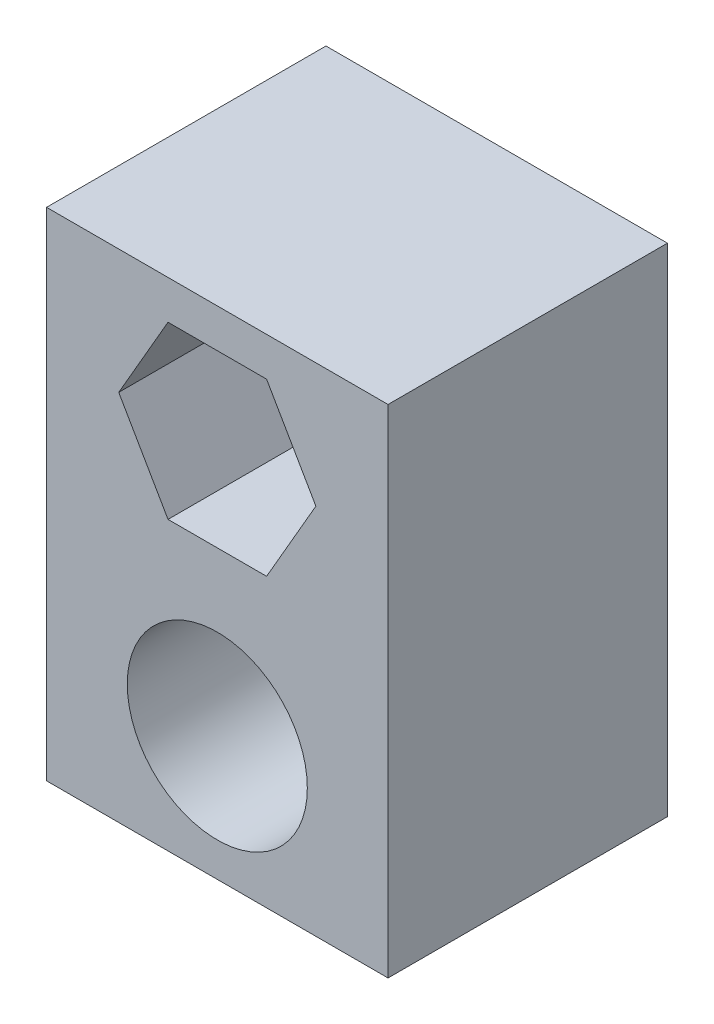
SolidWorks part; units mm, degrees
ref_plane "前视基准面" through (0, 0, 0) normal (0, 0, 1) x (1, 0, 0)
ref_plane "上视基准面" through (0, 0, 0) normal (0, 1, 0) x (1, 0, 0)
ref_plane "右视基准面" through (0, 0, 0) normal (1, 0, 0) x (0, 0, -1)
other "Configuration Table"
sketch "草图1" plane through (0, 0, 0) normal (0, 0, 1) x (1, 0, 0)
  line L1 (0, 0) -> (11, 0)
  line L2 (0, 0) -> (0, -16)
  line L3 (0, -16) -> (11, -16)
  line L4 (11, 0) -> (11, -16)
  dimension "D1" = 11
  dimension "D2" = 16
extrude "凸台-拉伸1" add sketch "草图1" along normal blind 9
sketch "草图2" plane through (0, 0, 9) normal (0, 0, 1) x (1, 0, 0)
  line L0 (11, -16) -> (11, 0) construction
  line L1 (8.6754, -4) -> (7.0877, -1.25)
  line L2 (7.0877, -1.25) -> (3.9123, -1.25)
  line L3 (3.9123, -1.25) -> (2.3246, -4)
  line L4 (2.3246, -4) -> (3.9123, -6.75)
  line L5 (3.9123, -6.75) -> (7.0877, -6.75)
  line L6 (7.0877, -6.75) -> (8.6754, -4)
  line L7 (11, 0) -> (0, 0) construction
  line L8 (0, -16) -> (11, -16) construction
  circle A0 centre (5.5, -4) radius 2.75 construction
  circle A1 centre (5.5, -12) radius 2.9
  dimension "D1" = 5.8
  dimension "D2" = 5.5
  dimension "D3" = 5.5
  dimension "D4" = 4
  dimension "D5" = 4
extrude "切除-拉伸1" cut sketch "草图2" against normal blind 5
sketch "草图3" plane through (0, 0, 4) normal (0, 0, 1) x (1, 0, 0)
  line L0 (5.5, -12) -> (5.5, -4) construction
  circle A0 centre (5.5, -12) radius 1.6
  circle A1 centre (5.5, -4) radius 1.6
  dimension "D3" = 3.2
  dimension "D2" = 8
  dimension "D1" = 2
extrude "切除-拉伸2" cut sketch "草图3" against normal through all and the other way through all
